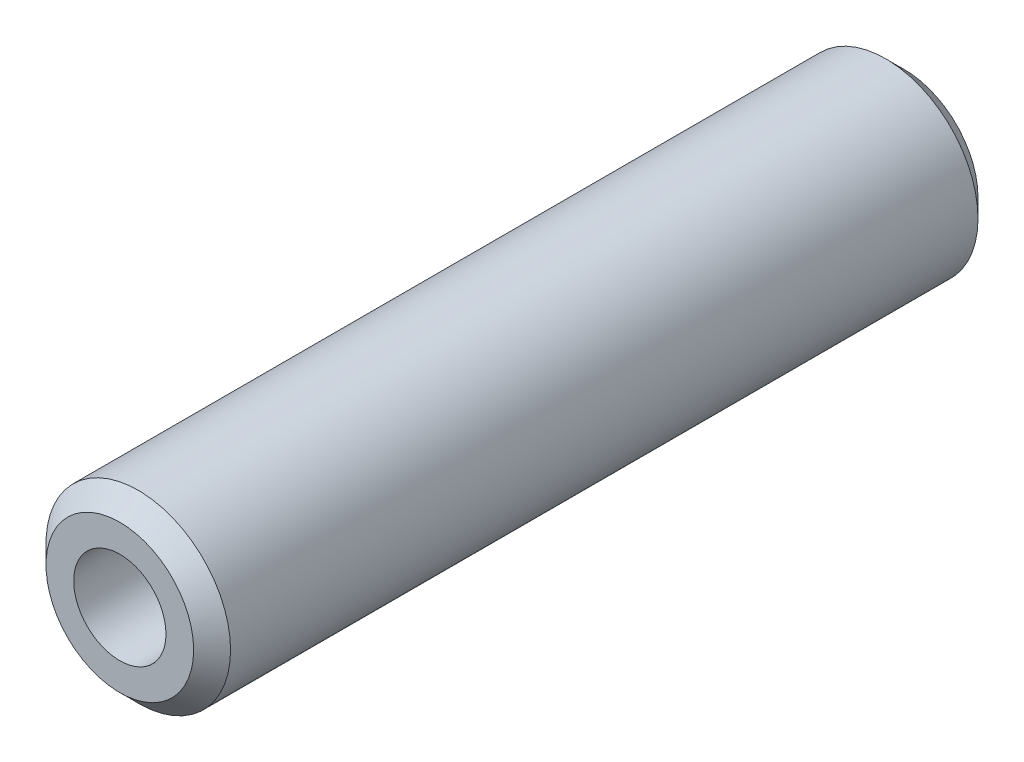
SolidWorks part; units mm, degrees
ref_plane "Face" through (0, 0, 0) normal (0, 0, 1) x (1, 0, 0)
ref_plane "Dessus" through (0, 0, 0) normal (0, 1, 0) x (1, 0, 0)
ref_plane "Droite" through (0, 0, 0) normal (1, 0, 0) x (0, 0, -1)
sketch "Esquisse1" plane through (0, 0, 0) normal (0, 0, 1) x (1, 0, 0)
  circle A0 centre (0, 0) radius 2
  circle A1 centre (0, 0) radius 1
  dimension "D1" = 4
  dimension "D2" = 1
extrude "Base-Extrusion" add sketch "Esquisse1" along normal mid plane 17
chamfer "Chanfrein2" distance 0.4 angle 45 2 edges at (2, 0, -8.5) (2, 0, 8.5)
